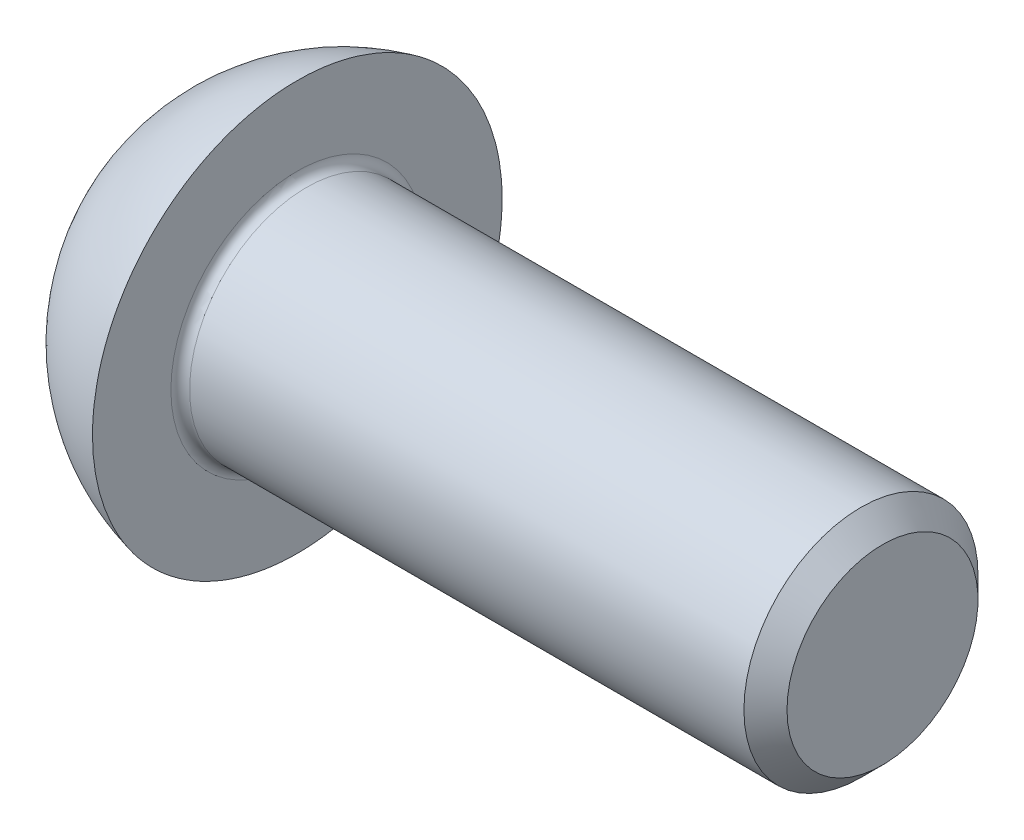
SolidWorks part; units mm, degrees
ref_plane "Front Plane" through (0, 0, 0) normal (0, 0, 1) x (1, 0, 0)
ref_plane "Top Plane" through (0, 0, 0) normal (0, 1, 0) x (1, 0, 0)
ref_plane "Right Plane" through (0, 0, 0) normal (1, 0, 0) x (0, 0, -1)
imported_body "Importée1"
sketch "Esquisse1" plane through (-5.5, 0, 0) normal (-1, 0, 0) x (0, 0, 1)
  circle A1 centre (0, 0) radius 1
  circle A2 centre (0, 0) radius 1
  dimension "D1" = 0
extrude "Enlèv. mat.-Extru.1" cut sketch "Esquisse1" against normal up to surface (3.12 mm away)
